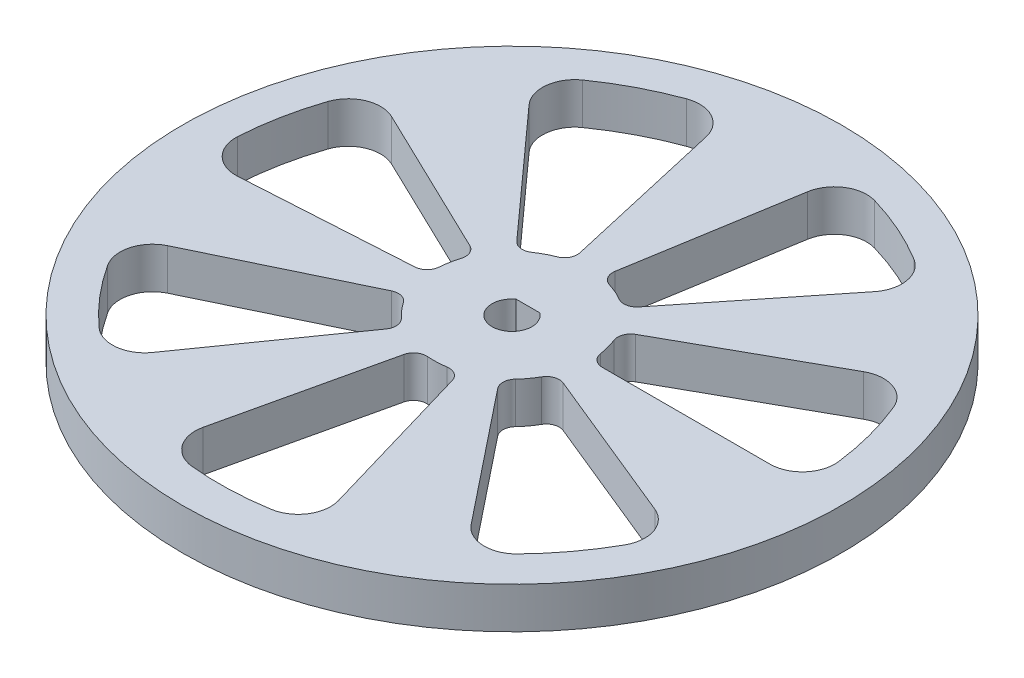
SolidWorks part; units mm, degrees
ref_plane "Front Plane" through (0, 0, 0) normal (0, 0, 1) x (1, 0, 0)
ref_plane "Top Plane" through (0, 0, 0) normal (0, 1, 0) x (1, 0, 0)
ref_plane "Right Plane" through (0, 0, 0) normal (1, 0, 0) x (0, 0, -1)
sketch "Sketch1" plane through (0, 0, 0) normal (0, 1, 0) x (1, 0, 0)
  line L0 (8.6834, -10.8887) -> (24.788, -31.0831)
  line L1 (12.9912, -5.0989) -> (36.8942, -14.8807)
  line L2 (13.9271, 0) -> (39.7568, 0)
  line L3 (12.0864, 6.9778) -> (34.6373, 19.5671)
  line L4 (1.8319, 2.4636) -> (-1.8319, 2.4636)
  line L5 (-3.0991, -13.5779) -> (-8.8467, -38.76)
  line L6 (4.1134, -13.336) -> (11.369, -38.123)
  line L7 (-12.5479, -6.0428) -> (-35.8197, -17.2498)
  line L8 (-7.8619, -11.5309) -> (-22.7173, -32.6579)
  line L9 (-12.5479, 6.0428) -> (-35.8197, 17.2498)
  line L10 (-13.917, -1.0427) -> (-39.697, -2.6008)
  line L11 (-3.0991, 13.5779) -> (-8.8467, 38.76)
  line L12 (-9.4923, 10.2306) -> (-26.7841, 29.4148)
  line L13 (8.6834, 10.8887) -> (24.788, 31.0831)
  line L14 (2.0802, 13.8001) -> (6.2978, 39.2805)
  circle A0 centre (0, 0) radius 50.8
  arc A1 (-1.8319, 2.4636) -> (1.8319, 2.4636) centre (0, 0) ccw
  arc A2 (44.7177, 5.6239) -> (41.7008, 17.0982) centre (0, 0) ccw
  arc A3 (11.9474, 1.7157) -> (11.2046, 4.4879) centre (0, 0) ccw
  arc A4 (39.7568, 0) -> (44.7177, 5.6239) centre (39.7568, 5) ccw
  arc A5 (34.6373, 19.5671) -> (41.7008, 17.0982) centre (37.0746, 15.2013) cw
  arc A6 (11.9474, 1.7157) -> (13.9271, 0) centre (13.9271, 2) ccw
  arc A7 (11.2046, 4.4879) -> (12.0864, 6.9778) centre (13.0612, 5.2315) cw
  arc A9 (32.278, -31.4553) -> (39.3679, -21.9424) centre (0, 0) ccw
  arc A10 (8.7905, -8.2712) -> (10.4947, -5.962) centre (0, 0) ccw
  arc A11 (24.788, -31.0831) -> (32.278, -31.4553) centre (28.6971, -27.9657) ccw
  arc A12 (36.8942, -14.8807) -> (39.3679, -21.9424) centre (35.0005, -19.5082) cw
  arc A13 (8.7905, -8.2712) -> (8.6834, -10.8887) centre (10.2471, -9.6417) ccw
  arc A14 (10.4947, -5.962) -> (12.9912, -5.0989) centre (12.2337, -6.9499) cw
  arc A15 (-4.4677, -44.848) -> (7.3902, -44.46) centre (0, 0) ccw
  arc A16 (-0.9859, -12.0297) -> (1.8821, -11.9224) centre (0, 0) ccw
  arc A17 (-8.8467, -38.76) -> (-4.4677, -44.848) centre (-3.9721, -39.8726) ccw
  arc A18 (11.369, -38.123) -> (7.3902, -44.46) centre (6.5704, -39.5277) cw
  arc A19 (-0.9859, -12.0297) -> (-3.0991, -13.5779) centre (-1.1492, -14.023) ccw
  arc A20 (1.8821, -11.9224) -> (4.1134, -13.336) centre (2.1939, -13.8979) cw
  arc A21 (-37.8492, -24.4693) -> (-30.1525, -33.4982) centre (0, 0) ccw
  arc A22 (-10.0199, -6.7296) -> (-8.1478, -8.9049) centre (0, 0) ccw
  arc A23 (-35.8197, -17.2498) -> (-37.8492, -24.4693) centre (-33.6502, -21.7547) ccw
  arc A24 (-22.7173, -32.6579) -> (-30.1525, -33.4982) centre (-26.8074, -29.782) cw
  arc A25 (-10.0199, -6.7296) -> (-12.5479, -6.0428) centre (-11.6801, -7.8447) ccw
  arc A26 (-8.1478, -8.9049) -> (-7.8619, -11.5309) centre (-9.4979, -10.3805) cw
  arc A27 (-42.7294, 14.3353) -> (-44.9898, 2.6884) centre (0, 0) ccw
  arc A28 (-11.5087, 3.638) -> (-12.0422, 0.8181) centre (0, 0) ccw
  arc A29 (-35.8197, 17.2498) -> (-42.7294, 14.3353) centre (-37.9891, 12.745) ccw
  arc A30 (-39.697, -2.6008) -> (-44.9898, 2.6884) centre (-39.9987, 2.3901) cw
  arc A31 (-11.5087, 3.638) -> (-12.5479, 6.0428) centre (-13.4157, 4.2408) ccw
  arc A32 (-12.0422, 0.8181) -> (-13.917, -1.0427) centre (-14.0376, 0.9536) cw
  arc A33 (-15.4335, 42.3451) -> (-25.9488, 36.8506) centre (0, 0) ccw
  arc A34 (-4.3312, 11.2661) -> (-6.8686, 9.9251) centre (0, 0) ccw
  arc A35 (-8.8467, 38.76) -> (-15.4335, 42.3451) centre (-13.7214, 37.6474) ccw
  arc A36 (-26.7841, 29.4148) -> (-25.9488, 36.8506) centre (-23.0701, 32.7624) cw
  arc A37 (-4.3312, 11.2661) -> (-3.0991, 13.5779) centre (-5.0489, 13.1329) ccw
  arc A38 (-6.8686, 9.9251) -> (-9.4923, 10.2306) centre (-8.0067, 11.5697) cw
  arc A39 (23.4841, 38.4682) -> (12.6321, 43.2635) centre (0, 0) ccw
  arc A40 (6.1077, 10.4106) -> (3.4772, 11.5583) centre (0, 0) ccw
  arc A41 (24.788, 31.0831) -> (23.4841, 38.4682) centre (20.8788, 34.2006) ccw
  arc A42 (6.2978, 39.2805) -> (12.6321, 43.2635) centre (11.2307, 38.464) cw
  arc A43 (6.1077, 10.4106) -> (8.6834, 10.8887) centre (7.1198, 12.1356) ccw
  arc A44 (3.4772, 11.5583) -> (2.0802, 13.8001) centre (4.0534, 13.4735) cw
  point P7 (45.07, 0)
  dimension "D1" = 5
  dimension "D2" = 2
  dimension "D3" = 42
  dimension "D4" = 9
  dimension "D5" = 101.6
  dimension "D6" = 3.07
  dimension "D7" = 2.4636
extrude "Extrude1" add sketch "Sketch1" along normal blind 6.35
